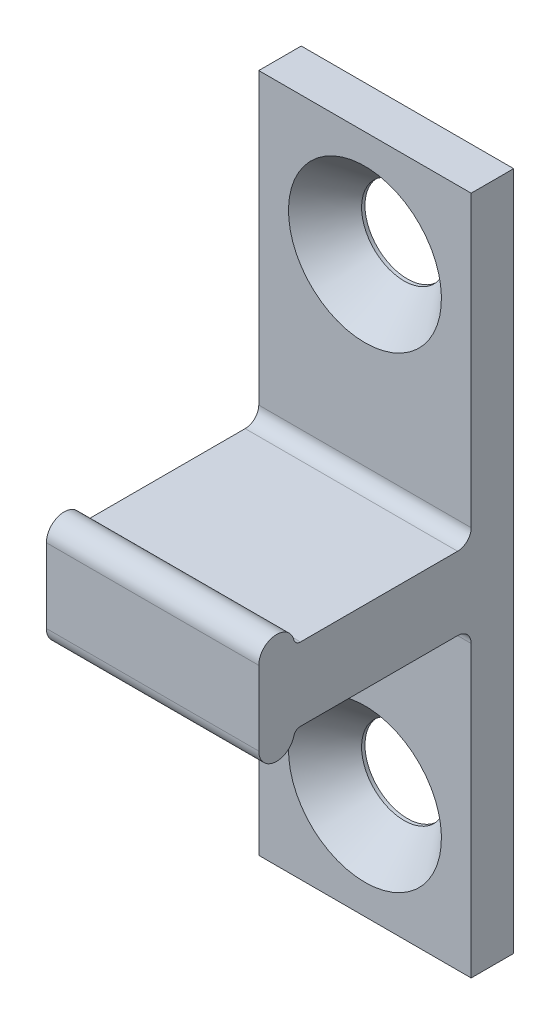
SolidWorks part; units mm, degrees
ref_plane "Front Plane" through (0, 0, 0) normal (0, 0, 1) x (1, 0, 0)
ref_plane "Top Plane" through (0, 0, 0) normal (0, 1, 0) x (1, 0, 0)
ref_plane "Right Plane" through (0, 0, 0) normal (1, 0, 0) x (0, 0, -1)
sketch "Sketch2" plane through (0, 0, 0) normal (1, 0, 0) x (0, 0, -1)
  line L0 (0, 0) -> (-9.525, 0) construction
  line L1 (0, 12.7) -> (-1.5875, 12.7)
  line L2 (0, 12.7) -> (0, -12.7)
  line L3 (0, -12.7) -> (-1.5875, -12.7)
  line L4 (-1.5875, 12.7) -> (-1.5875, 1.8733)
  line L5 (-1.5875, -1.3653) -> (-1.5875, -12.7)
  line L6 (-2.0955, 1.3653) -> (-7.967, 1.3653)
  line L7 (-9.525, 1.3876) -> (-9.525, -1.3876)
  line L8 (-2.0955, -1.3653) -> (-7.967, -1.3653)
  arc A5 (-8.2128, 1.5554) -> (-9.525, 1.3876) centre (-8.8582, 1.3876) ccw
  arc A6 (-7.967, 1.3653) -> (-8.2128, 1.5554) centre (-7.967, 1.6193) cw
  arc A7 (-2.0955, 1.3653) -> (-1.5875, 1.8733) centre (-2.0955, 1.8733) ccw
  arc A8 (-2.0955, -1.3653) -> (-1.5875, -1.8733) centre (-2.0955, -1.8733) cw
  arc A9 (-7.967, -1.3653) -> (-8.2128, -1.5554) centre (-7.967, -1.6193) ccw
  arc A10 (-8.2128, -1.5554) -> (-9.525, -1.3876) centre (-8.8582, -1.3876) cw
  arc A11 (-5.3978, -2.5083) -> (-8.8897, -2.5083) centre (-7.1438, -3.2703) ccw construction
  point P13 (-9.525, 0)
  point P15 (-1.5875, 1.3653)
  dimension "D3" = 0.254
  dimension "D4" = 0.508
  dimension "D5" = 9.525
  dimension "D1" = 1.5875
  dimension "D2" = 25.4
extrude "Boss-Extrude1" add sketch "Sketch2" along normal mid plane 7.9375
hole_wizard "CSK for #4 Flat Head Machine Screw1" positions "3DSketch1" profile "Sketch3" countersink size "#4" standard "ANSI Inch"
sketch3d "3DSketch1"
  line L0 (3.9688, 12.7, 1.5875) -> (-3.9688, 12.7, 1.5875) construction
  line L2 (3.9688, -12.7, 1.5875) -> (-3.9688, -12.7, 1.5875) construction
  point P0 (0, 8.7312, 1.5875)
  point P2 (0, -8.7312, 1.5875)
  point P10 (0, 12.7, 1.5875)
  dimension "D1" = 3.9688
  dimension "D2" = 3.9688
sketch "Sketch3" plane through (0, 8.7312, 1.5875) normal (1, 0, 0) x (0, -1, 0)
  line L0 (0, 0) -> (0, 1.5875)
  line L1 (0, 1.5875) -> (1.5875, 1.5875)
  line L2 (1.5875, 1.5875) -> (1.5875, 1.461)
  line L3 (1.5875, 1.461) -> (2.8575, 0)
  line L5 (2.8575, 0) -> (0, 0)
  line L6 (-1.5875, 1.461) -> (-2.8575, 0) construction
  line L11 (0, -6.35) -> (0, 107.95) construction
  dimension "Thru Hole Dia." = 3.175
  dimension "Thru Hole Depth" = 1.5875
  dimension "Near C'Sink Dia." = 5.715
  dimension "Near C'Sink Angle" = 82
